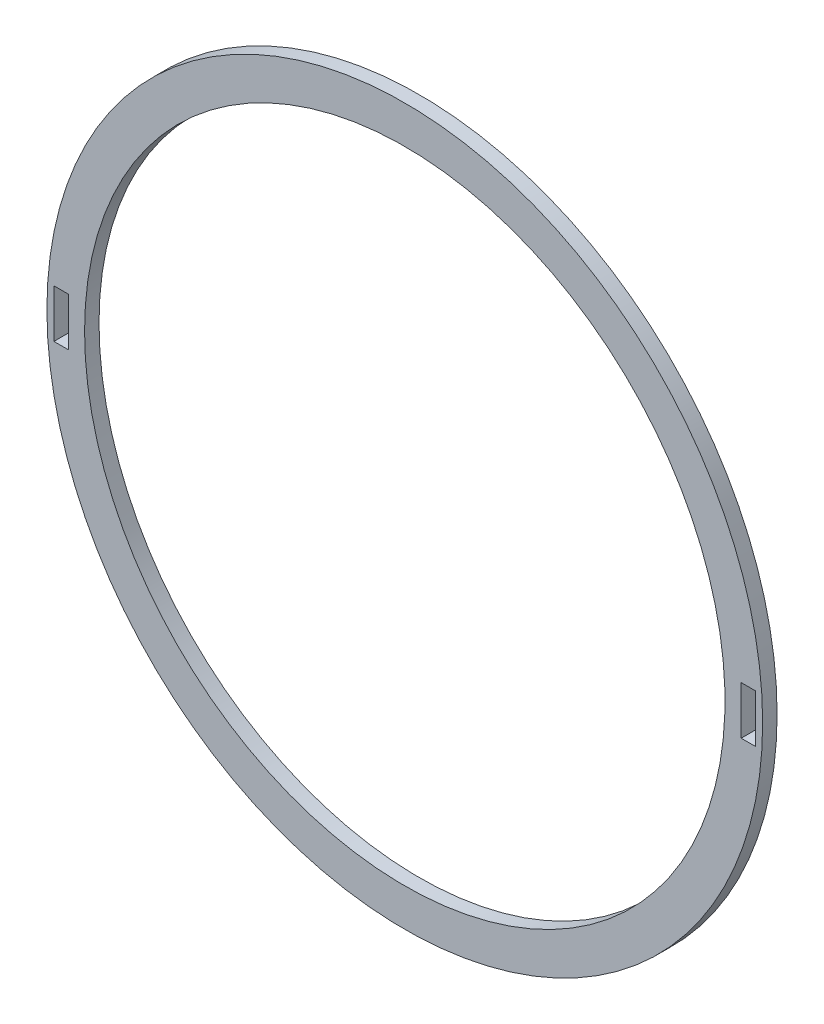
SolidWorks part; units mm, degrees
ref_plane "Front Plane" through (0, 0, 0) normal (0, 0, 1) x (1, 0, 0)
ref_plane "Top Plane" through (0, 0, 0) normal (0, 1, 0) x (1, 0, 0)
ref_plane "Right Plane" through (0, 0, 0) normal (1, 0, 0) x (0, 0, -1)
sketch "Sketch1" plane through (0, 0, 0) normal (0, 0, 1) x (1, 0, 0)
  line L0 (0, -12.6087) -> (0, -47.8909) construction
  line L1 (37.0095, 22.6012) -> (35.4855, 22.6012)
  line L2 (37.0095, 27.6812) -> (35.4855, 27.6812)
  line L3 (35.4855, 27.6812) -> (35.4855, 22.6012)
  line L4 (-37.0095, 27.6812) -> (-37.0095, 22.6012)
  line L5 (-35.4855, 27.6812) -> (-35.4855, 22.6012)
  line L6 (-37.0095, 27.6812) -> (-35.4855, 27.6812)
  line L7 (-37.0095, 22.6012) -> (-35.4855, 22.6012)
  line L8 (37.0095, 27.6812) -> (37.0095, 22.6012)
  circle A0 centre (0, 25.1412) radius 37.7499
  circle A1 centre (0, 25.1412) radius 33.7769
extrude "Boss-Extrude1" add sketch "Sketch1" along normal blind 1.524
